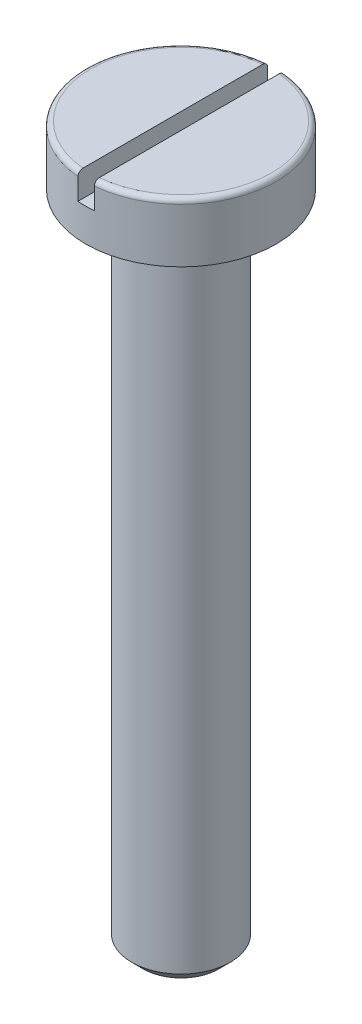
SolidWorks part; units mm, degrees
ref_plane "Face" through (0, 0, 0) normal (0, 0, 1) x (1, 0, 0)
ref_plane "Dessus" through (0, 0, 0) normal (0, 1, 0) x (1, 0, 0)
ref_plane "Droite" through (0, 0, 0) normal (1, 0, 0) x (0, 0, -1)
sketch "Esquisse1" plane through (0, 0, 0) normal (0, 1, 0) x (1, 0, 0)
  circle A0 centre (0, 0) radius 1.5
  dimension "D1" = 3
extrude "Base-Extrusion" add sketch "Esquisse1" against normal blind 20
sketch "Esquisse2" plane through (0, 0, 0) normal (0, 1, 0) x (-1, 0, 0)
  circle A0 centre (0, 0) radius 2.9
  dimension "D1" = 5.8
extrude "Boss.-Extru.1" add sketch "Esquisse2" along normal blind 1.8
fillet "Congé1" radius 0.15 1 edges at (0, 1.8, 2.9)
sketch "Esquisse3" plane through (0, 1.8, 0) normal (0, 1, 0) x (-1, 0, 0)
  line L0 (0, -3.072) -> (0, 3.2121) construction
  line L3 (-0.25, -2.8892) -> (-0.25, 2.8892)
  line L5 (0.25, -2.8892) -> (0.25, 2.8892)
  circle A0 centre (0, 0) radius 2.9 construction
  arc A1 (-0.25, -2.8892) -> (0.25, -2.8892) centre (0, 0) ccw
  arc A2 (0.25, 2.8892) -> (-0.25, 2.8892) centre (0, 0) ccw
  dimension "D1" = 0.5
extrude "Enlèv. mat.-Extru.1" cut sketch "Esquisse3" against normal blind 0.8
chamfer "Chanfrein1" distance 0.35 angle 45 1 edges at (0, -20, 1.5)
